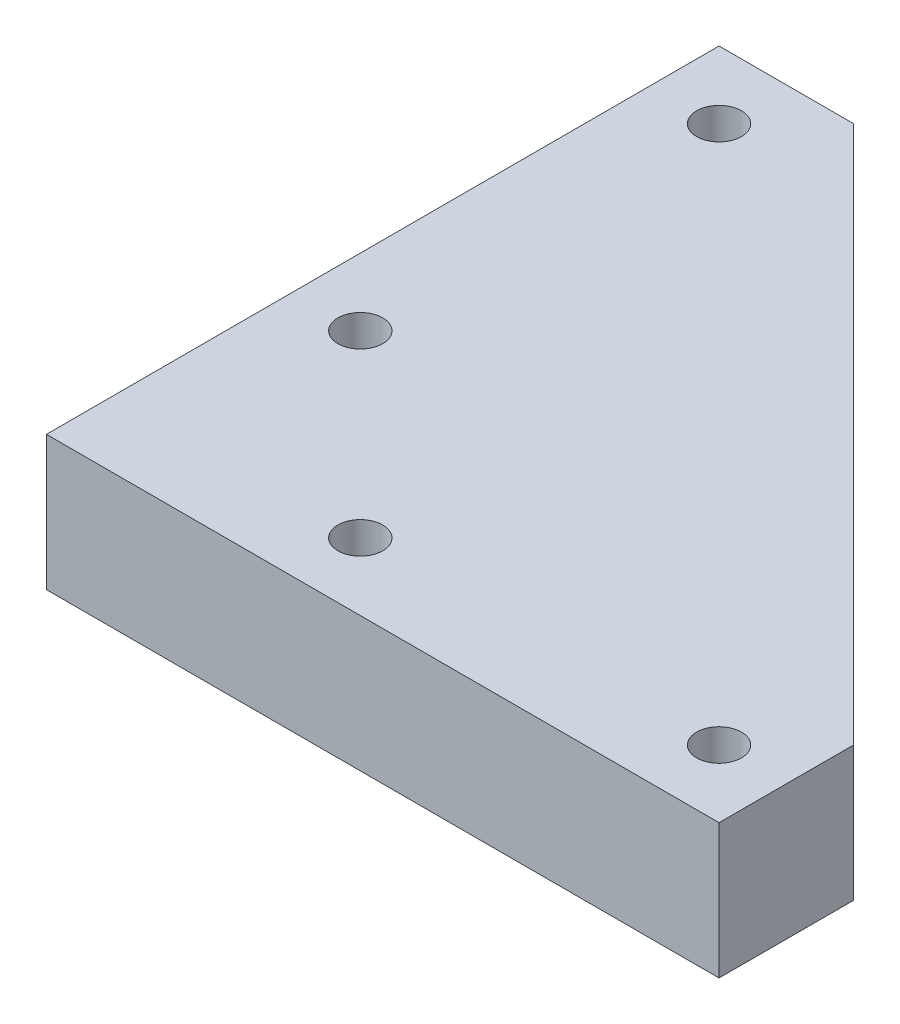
SolidWorks part; units mm, degrees
ref_plane "Front Plane" through (0, 0, 0) normal (0, 0, 1) x (1, 0, 0)
ref_plane "Top Plane" through (0, 0, 0) normal (0, 1, 0) x (1, 0, 0)
ref_plane "Right Plane" through (0, 0, 0) normal (1, 0, 0) x (0, 0, -1)
sketch "Sketch1" plane through (0, 0, 0) normal (0, 1, 0) x (1, 0, 0)
  line L0 (0, 0) -> (95.25, 0)
  line L1 (0, 0) -> (0, -95.25)
  line L2 (95.25, 0) -> (95.25, -95.25)
  line L3 (0, -95.25) -> (95.25, -95.25)
  dimension "D1" = 95.25
  dimension "D2" = 95.25
extrude "Boss-Extrude1" add sketch "Sketch1" along normal blind 19.05
sketch "Sketch2" plane through (0, 19.05, 0) normal (0, 1, 0) x (1, 0, 0)
  line L0 (19.05, 0) -> (95.25, -76.2)
  line L1 (19.05, 0) -> (85.885, 66.835)
  line L2 (95.25, -76.2) -> (162.085, -9.365)
  line L3 (85.885, 66.835) -> (162.085, -9.365)
  line L4 (95.25, 0) -> (0, 0) construction
  line L5 (95.25, -95.25) -> (95.25, 0) construction
  dimension "D1" = 19.05
  dimension "D2" = 19.05
extrude "Cut-Extrude1" cut sketch "Sketch2" against normal blind 19.05
hole_wizard "1/4 (0.25) Diameter Hole1" positions "Sketch4" profile "Sketch3" hole size "1/4" standard "ANSI Inch"
sketch "Sketch4" plane through (0, 19.05, 0) normal (0, 1, 0) x (1, 0, 0)
  line L0 (19.05, 0) -> (0, 0) construction
  line L1 (0, 0) -> (0, -95.25) construction
  point P0 (9.525, -9.525)
  point P3 (9.525, 0)
  dimension "D1" = 9.525
  dimension "D2" = 9.525
sketch "Sketch3" plane through (9.525, 19.05, 9.525) normal (1, 0, 0) x (0, 0, 1)
  line L0 (0, 0) -> (0, 19.05)
  line L1 (0, 19.05) -> (3.175, 19.05)
  line L2 (3.175, 19.05) -> (3.175, 0)
  line L5 (3.175, 0) -> (0, 0)
  line L11 (0, -6.35) -> (0, 107.95) construction
  dimension "Thru Hole Dia." = 6.35
  dimension "Thru Hole Depth" = 19.05
hole_wizard "1/4 (0.25) Diameter Hole2" positions "Sketch6" profile "Sketch5" hole size "1/4" standard "ANSI Inch"
sketch "Sketch6" plane through (0, 19.05, 0) normal (0, 1, 0) x (1, 0, 0)
  line L0 (95.25, -95.25) -> (95.25, -76.2) construction
  line L1 (0, -95.25) -> (95.25, -95.25) construction
  point P0 (85.725, -85.725)
  dimension "D1" = 9.525
  dimension "D2" = 9.525
sketch "Sketch5" plane through (85.725, 19.05, 85.725) normal (1, 0, 0) x (0, 0, 1)
  line L0 (0, 0) -> (0, 19.05)
  line L1 (0, 19.05) -> (3.175, 19.05)
  line L2 (3.175, 19.05) -> (3.175, 0)
  line L5 (3.175, 0) -> (0, 0)
  line L11 (0, -6.35) -> (0, 107.95) construction
  dimension "Thru Hole Dia." = 6.35
  dimension "Thru Hole Depth" = 19.05
hole_wizard "1/4 (0.25) Diameter Hole3" positions "Sketch8" profile "Sketch7" hole size "1/4" standard "ANSI Inch"
sketch "Sketch8" plane through (0, 19.05, 0) normal (0, 1, 0) x (1, 0, 0)
  line L0 (0, 0) -> (0, -95.25) construction
  circle A0 centre (9.525, -9.525) radius 3.175 construction
  point P0 (9.525, -60.325)
  dimension "D1" = 9.525
  dimension "D2" = 50.8
sketch "Sketch7" plane through (9.525, 19.05, 60.325) normal (1, 0, 0) x (0, 0, 1)
  line L0 (0, 0) -> (0, 19.05)
  line L1 (0, 19.05) -> (3.175, 19.05)
  line L2 (3.175, 19.05) -> (3.175, 0)
  line L5 (3.175, 0) -> (0, 0)
  line L11 (0, -6.35) -> (0, 107.95) construction
  dimension "Thru Hole Dia." = 6.35
  dimension "Thru Hole Depth" = 19.05
hole_wizard "1/4 (0.25) Diameter Hole4" positions "Sketch10" profile "Sketch9" hole size "1/4" standard "ANSI Inch"
sketch "Sketch10" plane through (0, 19.05, 0) normal (0, 1, 0) x (1, 0, 0)
  line L0 (0, -95.25) -> (95.25, -95.25) construction
  circle A0 centre (85.725, -85.725) radius 3.175 construction
  point P0 (34.925, -85.725)
  dimension "D2" = 50.8
  dimension "D1" = 9.525
sketch "Sketch9" plane through (34.925, 19.05, 85.725) normal (1, 0, 0) x (0, 0, 1)
  line L0 (0, 0) -> (0, 19.05)
  line L1 (0, 19.05) -> (3.175, 19.05)
  line L2 (3.175, 19.05) -> (3.175, 0)
  line L5 (3.175, 0) -> (0, 0)
  line L11 (0, -6.35) -> (0, 107.95) construction
  dimension "Thru Hole Dia." = 6.35
  dimension "Thru Hole Depth" = 19.05
